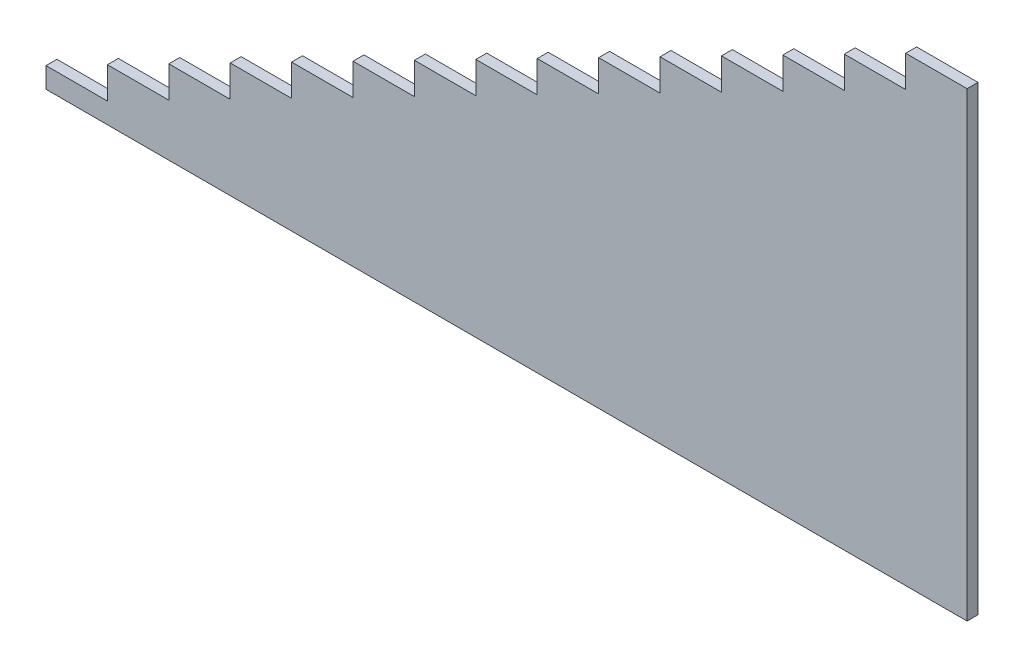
SolidWorks part; units mm, degrees
ref_plane "Front Plane" through (0, 0, 0) normal (0, 0, 1) x (1, 0, 0)
ref_plane "Top Plane" through (0, 0, 0) normal (0, 1, 0) x (1, 0, 0)
ref_plane "Right Plane" through (0, 0, 0) normal (1, 0, 0) x (0, 0, -1)
sketch "Sketch1" plane through (0, 0, 0) normal (0, 0, 1) x (1, 0, 0)
  line L0 (-999.236, 60.452) -> (-999.236, 36.576)
  line L1 (0, 0) -> (0, 548.64)
  line L2 (-71.374, 535.94) -> (-71.374, 512.064)
  line L3 (0, 548.64) -> (-71.374, 548.64) construction
  line L4 (0, 548.64) -> (0, 535.94) construction
  line L9 (0, 535.94) -> (-71.374, 535.94) construction
  line L10 (-71.374, 548.64) -> (-71.374, 535.94) construction
  line L11 (-71.374, 535.94) -> (0, 535.94)
  line L12 (-142.748, 499.364) -> (-142.748, 475.488)
  line L13 (-71.374, 512.064) -> (-142.748, 512.064) construction
  line L14 (-71.374, 512.064) -> (-71.374, 499.364) construction
  line L15 (-71.374, 499.364) -> (-142.748, 499.364) construction
  line L16 (-142.748, 512.064) -> (-142.748, 499.364) construction
  line L17 (-142.748, 499.364) -> (-71.374, 499.364)
  line L18 (-71.374, 499.364) -> (-71.374, 512.064)
  line L19 (-214.122, 462.788) -> (-214.122, 438.912)
  line L20 (-142.748, 475.488) -> (-214.122, 475.488) construction
  line L21 (-142.748, 475.488) -> (-142.748, 462.788)
  line L22 (-142.748, 462.788) -> (-214.122, 462.788)
  line L23 (-214.122, 475.488) -> (-214.122, 462.788) construction
  line L24 (-285.496, 426.212) -> (-285.496, 402.336)
  line L25 (-214.122, 438.912) -> (-285.496, 438.912) construction
  line L26 (-214.122, 438.912) -> (-214.122, 426.212)
  line L27 (-214.122, 426.212) -> (-285.496, 426.212)
  line L28 (-285.496, 438.912) -> (-285.496, 426.212) construction
  line L29 (-356.87, 389.636) -> (-356.87, 365.76)
  line L30 (-285.496, 402.336) -> (-356.87, 402.336) construction
  line L31 (-285.496, 402.336) -> (-285.496, 389.636)
  line L32 (-285.496, 389.636) -> (-356.87, 389.636)
  line L33 (-356.87, 402.336) -> (-356.87, 389.636) construction
  line L34 (-428.244, 353.06) -> (-428.244, 329.184)
  line L35 (-356.87, 365.76) -> (-428.244, 365.76) construction
  line L36 (-356.87, 365.76) -> (-356.87, 353.06)
  line L37 (-356.87, 353.06) -> (-428.244, 353.06)
  line L38 (-428.244, 365.76) -> (-428.244, 353.06) construction
  line L39 (-499.618, 316.484) -> (-499.618, 292.608)
  line L40 (-428.244, 329.184) -> (-499.618, 329.184) construction
  line L41 (-428.244, 329.184) -> (-428.244, 316.484)
  line L42 (-428.244, 316.484) -> (-499.618, 316.484)
  line L43 (-499.618, 329.184) -> (-499.618, 316.484) construction
  line L44 (-570.992, 279.908) -> (-570.992, 256.032)
  line L45 (-499.618, 292.608) -> (-570.992, 292.608) construction
  line L46 (-499.618, 292.608) -> (-499.618, 279.908)
  line L47 (-499.618, 279.908) -> (-570.992, 279.908)
  line L48 (-570.992, 292.608) -> (-570.992, 279.908) construction
  line L49 (-642.366, 243.332) -> (-642.366, 219.456)
  line L50 (-570.992, 256.032) -> (-642.366, 256.032) construction
  line L51 (-570.992, 256.032) -> (-570.992, 243.332)
  line L52 (-570.992, 243.332) -> (-642.366, 243.332)
  line L53 (-642.366, 256.032) -> (-642.366, 243.332) construction
  line L54 (-713.74, 206.756) -> (-713.74, 182.88)
  line L55 (-642.366, 219.456) -> (-713.74, 219.456) construction
  line L56 (-642.366, 219.456) -> (-642.366, 206.756)
  line L57 (-642.366, 206.756) -> (-713.74, 206.756)
  line L58 (-713.74, 219.456) -> (-713.74, 206.756) construction
  line L59 (-785.114, 170.18) -> (-785.114, 146.304)
  line L60 (-713.74, 182.88) -> (-785.114, 182.88) construction
  line L61 (-713.74, 182.88) -> (-713.74, 170.18)
  line L62 (-713.74, 170.18) -> (-785.114, 170.18)
  line L63 (-785.114, 182.88) -> (-785.114, 170.18) construction
  line L64 (-856.488, 133.604) -> (-856.488, 109.728)
  line L65 (-785.114, 146.304) -> (-856.488, 146.304) construction
  line L66 (-785.114, 146.304) -> (-785.114, 133.604)
  line L67 (-785.114, 133.604) -> (-856.488, 133.604)
  line L68 (-856.488, 146.304) -> (-856.488, 133.604) construction
  line L69 (-927.862, 97.028) -> (-927.862, 73.152)
  line L70 (-856.488, 109.728) -> (-927.862, 109.728) construction
  line L71 (-856.488, 109.728) -> (-856.488, 97.028)
  line L72 (-856.488, 97.028) -> (-927.862, 97.028)
  line L73 (-927.862, 109.728) -> (-927.862, 97.028) construction
  line L74 (-927.862, 73.152) -> (-999.236, 73.152) construction
  line L75 (-927.862, 73.152) -> (-927.862, 60.452)
  line L76 (-927.862, 60.452) -> (-999.236, 60.452)
  line L77 (-999.236, 73.152) -> (-999.236, 60.452) construction
  line L78 (-1070.61, 23.876) -> (-1070.61, 0)
  line L79 (-999.236, 36.576) -> (-1070.61, 36.576) construction
  line L80 (-999.236, 36.576) -> (-999.236, 23.876)
  line L81 (-999.236, 23.876) -> (-1070.61, 23.876)
  line L82 (-1070.61, 36.576) -> (-1070.61, 23.876) construction
  line L83 (0, 0) -> (-1070.61, 0)
  dimension "D1" = 548.64
  dimension "D2" = 12.7
  dimension "D3" = 71.374
  dimension "D4" = 36.576
extrude "Boss-Extrude1" add sketch "Sketch1" along normal blind 12.7
sketch "Sketch2" plane through (0, 97.028, 0) normal (0, 1, 0) x (1, 0, 0)
  line L0 (-927.862, -6.35) -> (-856.488, -6.35)
  line L1 (-927.862, -12.7) -> (-927.862, 0) construction
  line L2 (-856.488, -12.7) -> (-856.488, 0) construction
